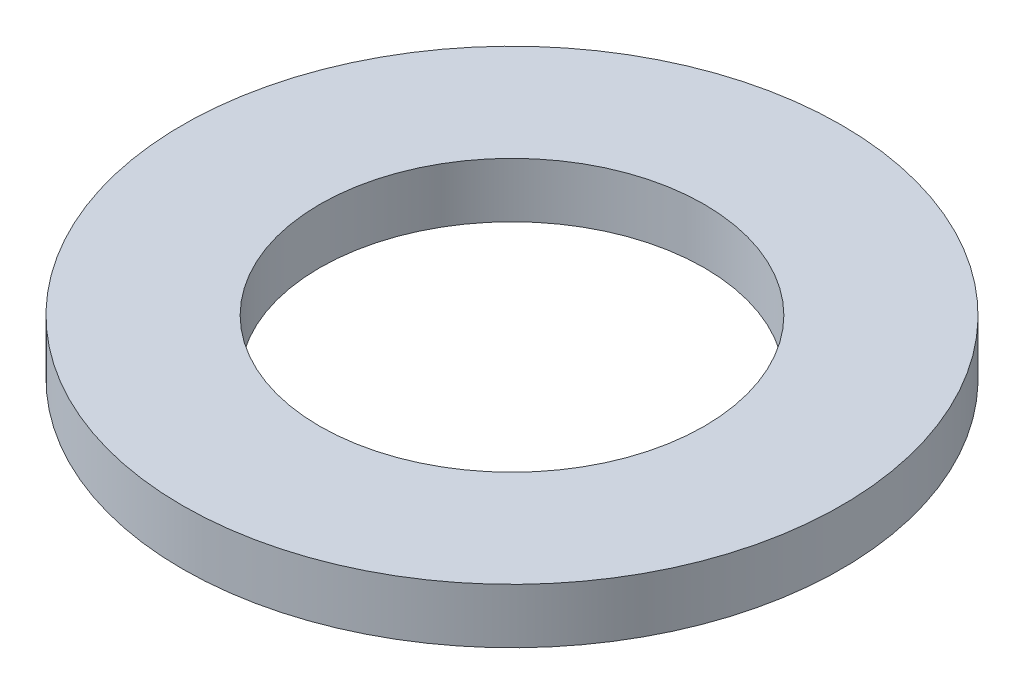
SolidWorks part; units mm, degrees
ref_plane "Front" through (0, 0, 0) normal (0, 0, 1) x (1, 0, 0)
ref_plane "Top" through (0, 0, 0) normal (0, 1, 0) x (1, 0, 0)
ref_plane "Right" through (0, 0, 0) normal (1, 0, 0) x (0, 0, -1)
sketch "Sketch1" plane through (0, 0, 0) normal (0, 1, 0) x (1, 0, 0)
  circle A0 centre (0, 0) radius 35
  circle A1 centre (0, 0) radius 60
extrude "Extrude1" add sketch "Sketch1" along normal blind 10
